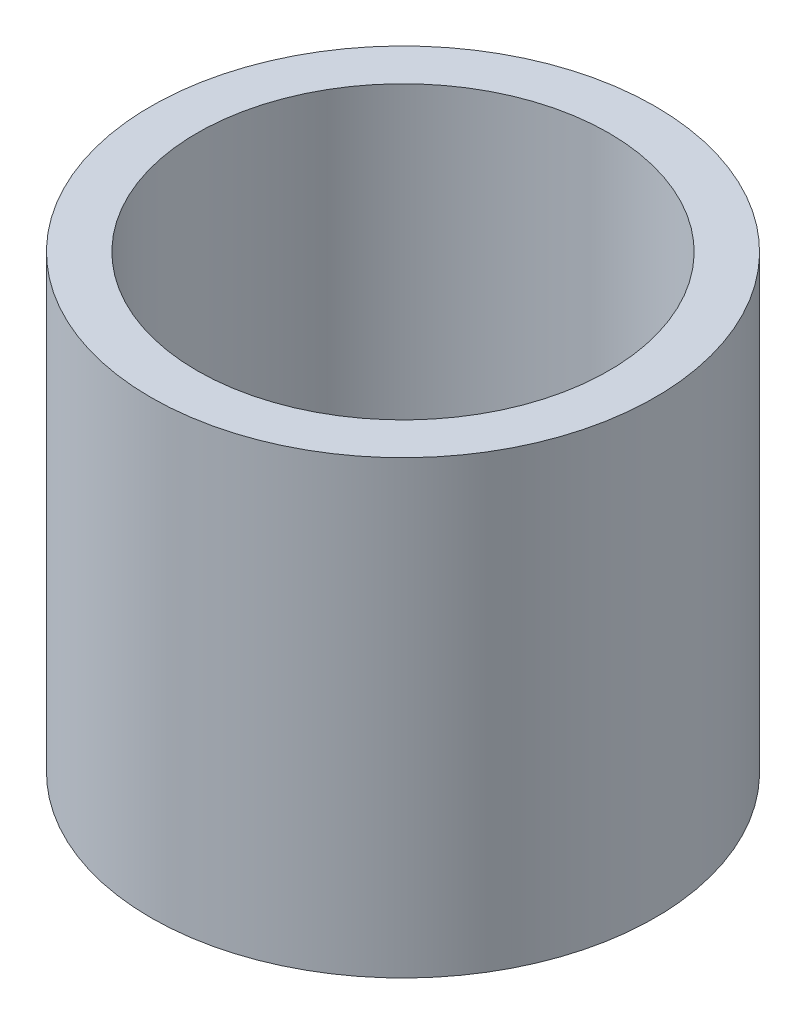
SolidWorks part; units mm, degrees
ref_plane "Front Plane" through (0, 0, 0) normal (0, 0, 1) x (1, 0, 0)
ref_plane "Top Plane" through (0, 0, 0) normal (0, 1, 0) x (1, 0, 0)
ref_plane "Right Plane" through (0, 0, 0) normal (1, 0, 0) x (0, 0, -1)
sketch "Sketch4" plane through (0, 0, 0) normal (0, 1, 0) x (1, 0, 0)
  circle A0 centre (0, 0) radius 28.2575
  circle A1 centre (0, 0) radius 34.6075
  dimension "D1" = 56.515
  dimension "D2" = 69.215
extrude "Boss-Extrude1" add sketch "Sketch4" along normal blind 61.8465
